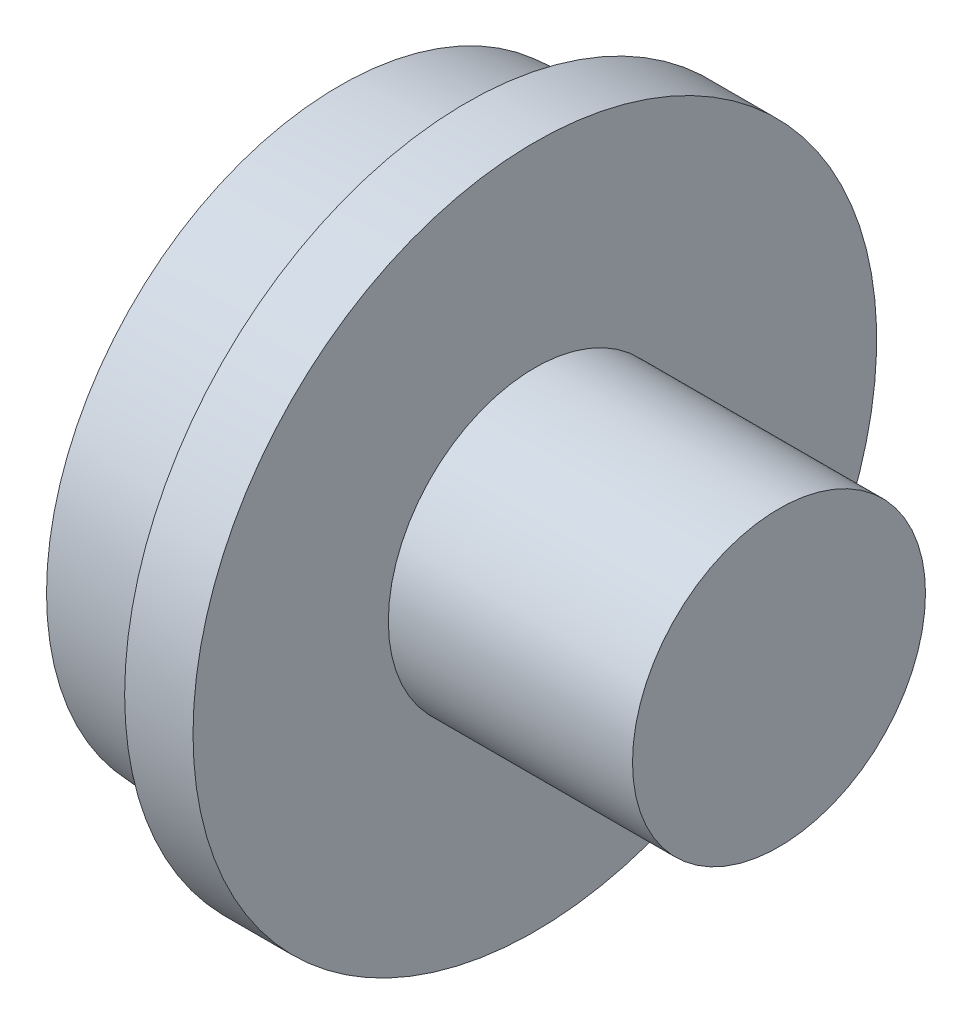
SolidWorks part; units mm, degrees
ref_plane "Plan de face" through (0, 0, 0) normal (0, 0, 1) x (1, 0, 0)
ref_plane "Plan de dessus" through (0, 0, 0) normal (0, 1, 0) x (1, 0, 0)
ref_plane "Plan de droite" through (0, 0, 0) normal (1, 0, 0) x (0, 0, -1)
sketch "Esquisse1" plane through (0, 0, 0) normal (0, 0, 1) x (1, 0, 0)
  line L0 (-50, 70) -> (-50, 30)
  line L1 (-50, 70) -> (-64, 70)
  line L2 (-64, 70) -> (-64, 61.9549)
  line L3 (-64, 61.9549) -> (-90, 60)
  line L4 (-90, 60) -> (-90, 45)
  line L5 (-90, 45) -> (-100, 45)
  line L6 (-100, 45) -> (-100, 0)
  line L7 (-100, 0) -> (0, 0)
  line L8 (-50, 30) -> (0, 30)
  line L9 (0, 30) -> (0, 0)
  dimension "D1" = 70
  dimension "D2" = 14
  dimension "D3" = 4.3
  dimension "D4" = 100
  dimension "D5" = 15
  dimension "D6" = 50
  dimension "D7" = 30
  dimension "D8" = 45
  dimension "D9" = 10
revolve "Révolution1" add sketch "Esquisse1" angle 360 about L7
